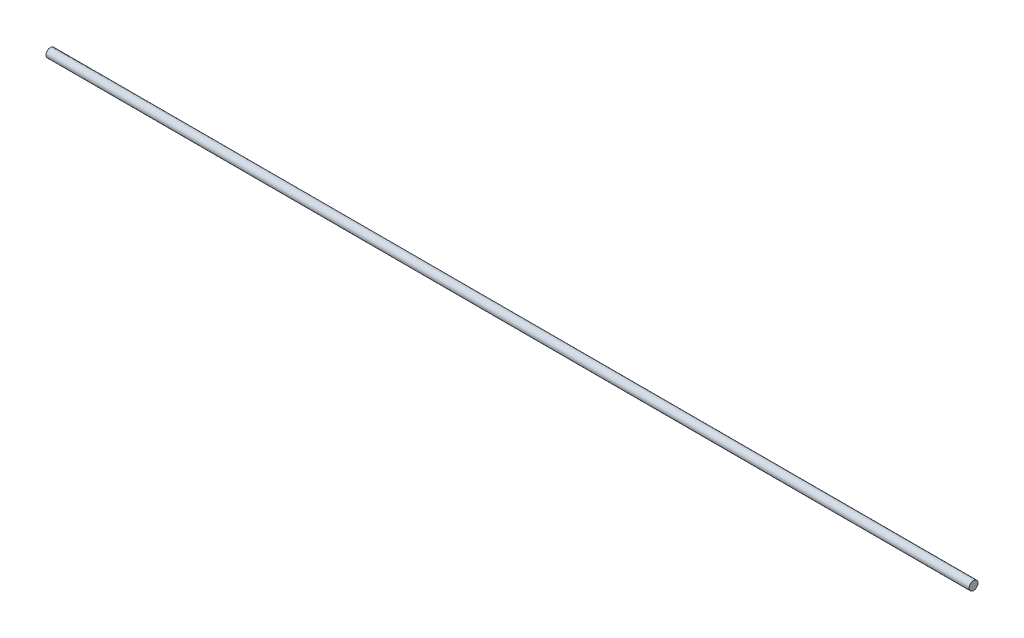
SolidWorks part; units mm, degrees
ref_plane "Front Plane" through (0, 0, 0) normal (1, 0, 0) x (0, 1, 0)
ref_plane "Top Plane" through (0, 0, 0) normal (0, 0, 1) x (0, 1, 0)
ref_plane "Right Plane" through (0, 0, 0) normal (0, 1, 0) x (-1, 0, 0)
sketch "Sketch1" plane through (0, 0, 0) normal (1, 0, 0) x (0, 1, 0)
  circle A0 centre (0, 0) radius 28.6639
  dimension "D1" = 57.3278
extrude "N18 - 2.257in - 20ft" add sketch "Sketch1" along normal mid plane 5993.1
ref_plane "6.9in offset 1" through (2821.675, 0, 0) normal (1, 0, 0) x (0, 1, 0)
ref_plane "6.9in offset 2" through (-2821.675, 0, 0) normal (-1, 0, 0) x (0, -1, 0)
